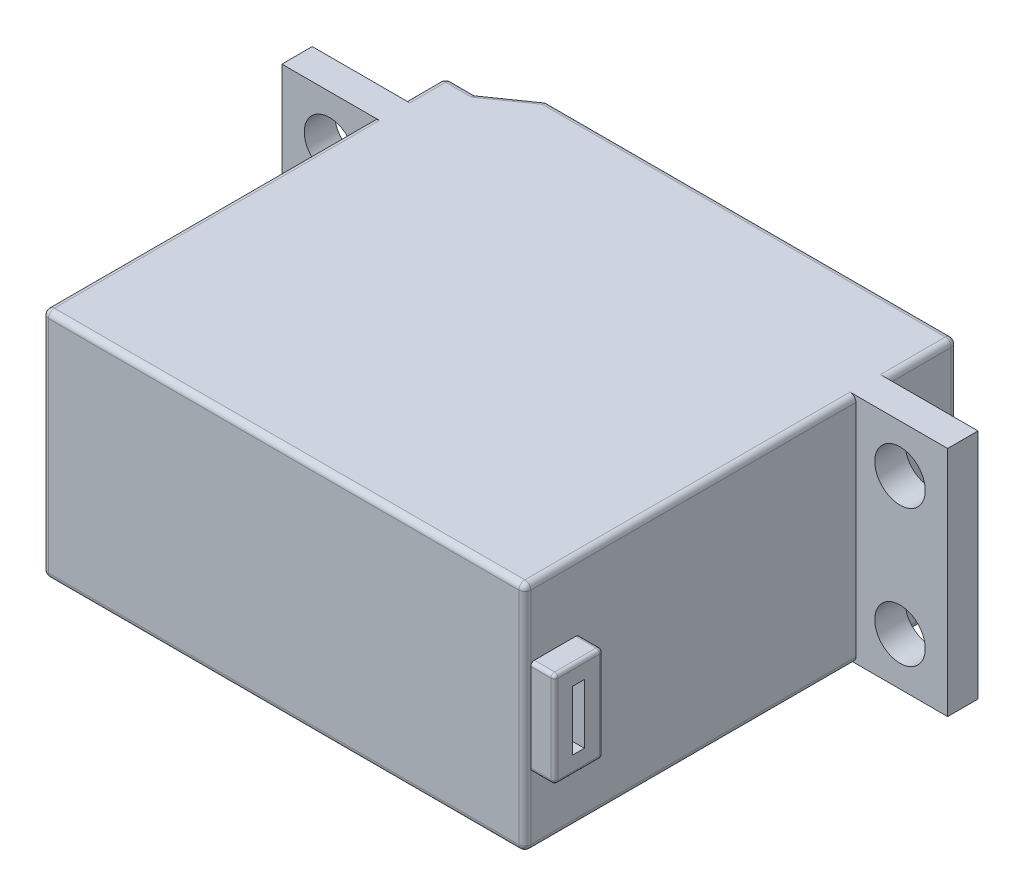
SolidWorks part; units mm, degrees
ref_plane "Plan de face" through (0, 0, 0) normal (0, 0, 1) x (1, 0, 0)
ref_plane "Plan de dessus" through (0, 0, 0) normal (0, 1, 0) x (1, 0, 0)
ref_plane "Plan de droite" through (0, 0, 0) normal (1, 0, 0) x (0, 0, -1)
sketch "Esquisse1" plane through (0, 0, 0) normal (0, 1, 0) x (1, 0, 0)
  line L0 (-25.889, 0) -> (79.3296, 0) construction
  line L1 (0, -14.8446) -> (0, 58.5471) construction
  line L2 (-25.889, 36.3) -> (67.6914, 36.3) construction
  line L3 (40.5, 58.5471) -> (40.5, -14.8446) construction
  line L4 (-15.7265, 27.8) -> (67.6914, 27.8) construction
  line L5 (-15.7265, 30.35) -> (14.0657, 30.35) construction
  line L6 (20.25, 1.9538) -> (20.25, -5.5638) construction
  line L7 (-7.7, 33.6023) -> (-7.7, 17.2676) construction
  line L8 (13.2304, 33.85) -> (-2.733, 33.85) construction
  line L9 (21, 45.018) -> (21, 33.6023) construction
  line L10 (0, 27.8) -> (-7.7, 27.8)
  line L11 (-7.7, 27.8) -> (-7.7, 30.35)
  line L12 (-7.7, 30.35) -> (0, 30.35)
  line L13 (48.2, 27.8) -> (48.2, 30.35)
  line L14 (40.5, 27.8) -> (48.2, 27.8)
  line L15 (48.2, 30.35) -> (40.5, 30.35)
  line L16 (40.5, 27.8) -> (40.5, 0)
  line L17 (40.5, 0) -> (0, 0)
  line L18 (0, 0) -> (0, 27.8)
  line L19 (2.5, 41.6768) -> (2.5, 31.8389) construction
  line L20 (6, 41.6768) -> (6, 31.8389) construction
  line L21 (0, 30.35) -> (0, 33.85)
  line L22 (0, 33.85) -> (2.5, 33.85)
  line L23 (2.5, 33.85) -> (6, 36.3)
  line L24 (6, 36.3) -> (40.5, 36.3)
  line L25 (40.5, 36.3) -> (40.5, 30.35)
  dimension "D1" = 36.3
  dimension "D2" = 40.5
  dimension "D3" = 20.25
  dimension "D4" = 27.8
  dimension "D5" = 2.55
  dimension "D6" = 3.5
  dimension "D7" = 19.5
  dimension "D8" = 2.5
  dimension "D9" = 3.5
  dimension "D10" = 7.7
extrude "Extrusion1" add sketch "Esquisse1" along normal blind 19.5
sketch "Esquisse3" plane through (0, 0, -30.35) normal (0, 0, -1) x (-1, 0, 0)
  line L0 (0, -5.9051) -> (0, 25.0355) construction
  line L1 (-20.25, -5.9051) -> (-20.25, 25.0355) construction
  line L2 (12.0106, 0) -> (-51.1906, 0) construction
  line L3 (-51.1906, 9.75) -> (12.0106, 9.75) construction
  line L4 (11.1658, 4) -> (-6.9445, 4) construction
  line L5 (3.7, -4.8491) -> (3.7, 13.842) construction
  line L6 (7.7, 19.5) -> (7.7, 0) construction
  circle A0 centre (3.7, 4) radius 2.12
  circle A1 centre (3.7, 15.5) radius 2.12
  circle A2 centre (-44.2, 15.5) radius 2.12
  circle A3 centre (-44.2, 4) radius 2.12
  dimension "D1" = 20.25
  dimension "D2" = 9.75
  dimension "D3" = 4
  dimension "D4" = 4
extrude "Enlèv. mat.-Extru.1" cut sketch "Esquisse3" against normal through all
sketch "Esquisse4" plane through (0, 0, -36.3) normal (0, 0, -1) x (-1, 0, 0)
  line L0 (-40.5, -8.0171) -> (-40.5, 24.1379) construction
  line L1 (-52.2994, 9.75) -> (-24.4212, 9.75) construction
  line L2 (-30.75, -8.0171) -> (-30.75, 14.8452) construction
  line L3 (-52.2994, 0) -> (9.4762, 0) construction
  circle A0 centre (-30.75, 9.75) radius 6.8
  dimension "D1" = 9.75
  dimension "D2" = 9.75
extrude "Extrusion2" add sketch "Esquisse4" along normal blind 2
sketch "Esquisse5" plane through (0, 0, -38.3) normal (0, 0, -1) x (-1, 0, 0)
  line L0 (-30.75, 1.3812) -> (-30.75, 12.0996) construction
  line L1 (-21.2532, 9.75) -> (-32.3939, 9.75) construction
  circle A0 centre (-30.75, 9.75) radius 3
extrude "Extrusion3" add sketch "Esquisse5" along normal blind 3.5
chamfer "Chanfrein1" distance 2 angle 45 1 edges at (23.95, 9.75, -38.3)
sketch "Esquisse6" plane through (0, 0, -30.35) normal (0, 0, -1) x (-1, 0, 0)
  line L0 (0, -5.7567) -> (0, 29.5781) construction
  line L1 (12.5532, 0) -> (-6.1576, 0) construction
  line L2 (12.5532, 9.75) -> (-6.6444, 9.75) construction
  line L3 (4, 25.0708) -> (4, 6.6522) construction
  line L4 (-20.25, 29.5781) -> (-20.25, -5.7567) construction
  line L5 (-44.5, 10.5) -> (-40.5, 10.5)
  line L6 (4, 9) -> (0, 9)
  line L7 (4, 9) -> (4, 10.5)
  line L8 (4, 10.5) -> (0, 10.5)
  line L9 (0, 9) -> (0, 10.5)
  line L10 (-40.5, 9) -> (-40.5, 10.5)
  line L11 (-44.5, 9) -> (-40.5, 9)
  line L12 (-44.5, 9) -> (-44.5, 10.5)
  dimension "D1" = 20.25
  dimension "D2" = 9.75
  dimension "D3" = 4
  dimension "D4" = 1.5
  dimension "D5" = 0.75
extrude "Extrusion4" add sketch "Esquisse6" along normal blind 2
chamfer "Chanfrein2" distance 1 angle 60 2 edges at (44.5, 9.75, -32.35) (-4, 9.75, -32.35)
sketch "Esquisse8" plane through (40.5, 0, 0) normal (1, 0, 0) x (0, 0, -1)
  line L0 (0.5872, 21.9631) -> (0.5872, -5.0342) construction
  line L1 (4.5872, -1.7995) -> (4.5872, 21.9631) construction
  line L2 (-2.0747, 9.75) -> (10.8641, 9.75) construction
  line L3 (-5.3508, 0) -> (16.6285, 0) construction
  line L5 (0.5, 13.75) -> (4.5872, 13.75)
  line L6 (0.5, 13.75) -> (0.5, 5.75)
  line L7 (0.5, 5.75) -> (4.5872, 5.75)
  line L8 (4.5872, 13.75) -> (4.5872, 5.75)
  line L9 (2, 12.25) -> (3, 12.25)
  line L10 (2, 12.25) -> (2, 7.25)
  line L11 (2, 7.25) -> (3, 7.25)
  line L12 (3, 12.25) -> (3, 7.25)
  dimension "D1" = 9.75
  dimension "D2" = 4
  dimension "D3" = 8
  dimension "D4" = 4
  dimension "D5" = 1
  dimension "D6" = 5
  dimension "D7" = 1.5
  dimension "D8" = 1.5
extrude "Extrusion5" add sketch "Esquisse8" along normal blind 2
fillet "Congé2" radius 0.5 20 edges at (0, 0, -32.1) (1.25, 0, -33.85) (4.25, 0, -35.075) (23.25, 0, -36.3) (40.5, 9.75, -36.3) (40.5, 0, -33.325) (40.5, 0, -13.9) (0, 19.5, -32.1) (1.25, 19.5, -33.85) (4.25, 19.5, -35.075) (23.25, 19.5, -36.3) (40.5, 19.5, -33.325) (40.5, 19.5, -13.9) (40.5, 9.75, 0) (20.25, 0, 0) (20.25, 19.5, 0) (0, 0, -13.9) (0, 9.75, 0) (0, 19.5, -13.9) (0, 9.75, -33.85)
fillet "Congé3" radius 0.3 8 edges at (42.5, 13.75, -2.5436) (42.5, 9.75, -0.5) (42.5, 9.75, -4.5872) (41.5, 5.75, -4.5872) (42.5, 5.75, -2.5436) (41.5, 13.75, -4.5872) (41.5, 13.75, -0.5) (41.5, 5.75, -0.5)
